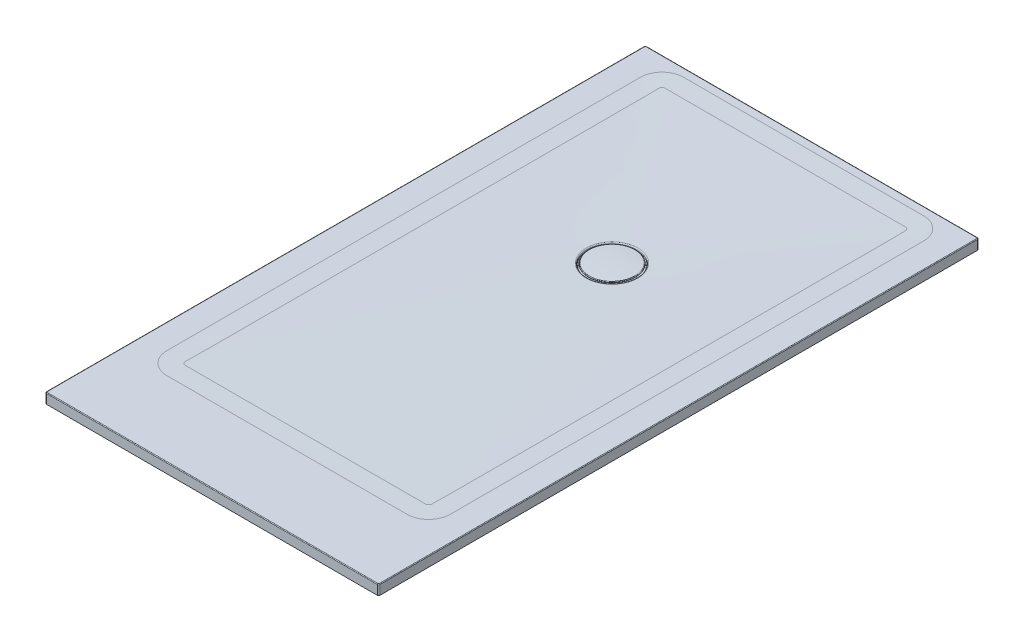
SolidWorks part; units mm, degrees
ref_plane "Płaszczyzna przednia" through (0, 0, 0) normal (0, 0, 1) x (1, 0, 0)
ref_plane "Płaszczyzna górna" through (0, 0, 0) normal (0, 1, 0) x (1, 0, 0)
ref_plane "Płaszczyzna prawa" through (0, 0, 0) normal (1, 0, 0) x (0, 0, -1)
sketch "Szkic2" plane through (0, 0, 0) normal (0, 1, 0) x (1, 0, 0)
  line L0 (0, 900) -> (0, 300) construction
  line L1 (-500, -900) -> (500, -900)
  line L2 (-500, -900) -> (-500, 900)
  line L3 (-500, 900) -> (500, 900)
  line L4 (500, -900) -> (500, 900)
  line L5 (-500, -900) -> (500, 900) construction
  line L6 (-500, 900) -> (500, -900) construction
  line L7 (-410, 860) -> (410, 860)
  line L8 (-410, 860) -> (-410, -660)
  line L9 (-410, -660) -> (410, -660)
  line L10 (410, 860) -> (410, -660)
  line L11 (-450, 900) -> (-450, -700) construction
  line L12 (-450, -700) -> (450, -700) construction
  line L13 (450, -700) -> (450, 900) construction
  circle A0 centre (0, 300) radius 75
  point P0 (0, 0)
  point P11 (0, 860)
  point P16 (0, -700)
  dimension "D9" = 150
  dimension "D1" = 1000
  dimension "D2" = 1800
  dimension "D3" = 40
  dimension "D4" = 90
  dimension "D5" = 40
  dimension "D6" = 50
  dimension "D7" = 1600
  dimension "D8" = 600
  dimension "D10" = 900
sketch "Szkic3" plane through (0, 0, 0) normal (0, 1, 0) x (1, 0, 0)
  line L0 (-500, -900) -> (-500, 900) construction
  line L1 (-500, -900) -> (500, -900) construction
  line L2 (500, -900) -> (500, 900) construction
  line L3 (-500, 900) -> (500, 900) construction
  line L4 (-410, 860) -> (-410, -660) construction
  line L5 (-410, 860) -> (410, 860) construction
  line L6 (410, 860) -> (410, -660) construction
  line L7 (-410, -660) -> (410, -660) construction
  line L8 (-500, -900) -> (-500, 900)
  line L9 (-500, -900) -> (500, -900)
  line L10 (500, -900) -> (500, 900)
  line L11 (-500, 900) -> (500, 900)
  line L12 (-410, 810) -> (-410, -610)
  line L13 (-360, 860) -> (360, 860)
  line L14 (410, 810) -> (410, -610)
  line L15 (-360, -660) -> (360, -660)
  arc A0 (410, 810) -> (360, 860) centre (360, 810) ccw
  arc A1 (-360, 860) -> (-410, 810) centre (-360, 810) ccw
  arc A2 (360, -660) -> (410, -610) centre (360, -610) ccw
  arc A3 (-360, -660) -> (-410, -610) centre (-360, -610) cw
  dimension "D1" = 50
surface "Powierzchnia-Płaszczyzna1" sketch "Szkic3"
sketch "Szkic4" plane through (0, 0, 0) normal (0, 1, 0) x (1, 0, 0)
  line L0 (-410, 860) -> (-410, -660) construction
  line L1 (-410, -660) -> (410, -660) construction
  line L2 (410, 860) -> (410, -660) construction
  line L3 (-410, 860) -> (410, 860) construction
  line L4 (-410, 860) -> (-410, -660)
  line L5 (-410, -660) -> (410, -660)
  line L6 (410, 860) -> (410, -660)
  line L7 (-410, 860) -> (410, 860)
ref_plane "korek" through (0, -15, 0) normal (0, 1, 0) x (-1, 0, 0)
sketch "Szkic5" plane through (0, -15, 0) normal (0, 1, 0) x (-1, 0, 0)
  circle A0 centre (0, -300) radius 75 construction
  circle A1 centre (0, -300) radius 75
surface "Powierzchnia-Wyciągnięcie po profilach2"
surface "Powierzchnia-Połącz1"
sketch "Szkic7" plane through (0, 0, 0) normal (0, 1, 0) x (1, 0, 0)
  line L27 (360, 820) -> (-360, 820)
  line L28 (-370, 810) -> (-370, -610)
  line L29 (-360, -620) -> (360, -620)
  line L30 (370, -610) -> (370, 810)
  line L31 (360, 820) -> (-360, 820)
  line L32 (-370, 810) -> (-370, -610)
  line L33 (-360, -620) -> (360, -620)
  line L34 (370, -610) -> (370, 810)
  line L35 (360, 875) -> (-360, 875)
  line L36 (-425, 810) -> (-425, -610)
  line L37 (-360, -675) -> (360, -675)
  line L38 (425, -610) -> (425, 810)
  line L39 (360, 875) -> (-360, 875)
  line L40 (-425, 810) -> (-425, -610)
  line L41 (-360, -675) -> (360, -675)
  line L42 (425, -610) -> (425, 810)
  arc A0 (370, -610) -> (360, -620) centre (360, -610) cw
  arc A1 (-370, -610) -> (-360, -620) centre (-360, -610) ccw
  arc A2 (370, 810) -> (360, 820) centre (360, 810) ccw
  arc A3 (-370, 810) -> (-360, 820) centre (-360, 810) cw
  spline S23 degree 3 poles (-582.3664, 505.0465) (46.9984, 660.4805) (379.1477, 765.2945) (369.7444, 812.2675) (369.6661, 812.5844) (369.4755, 813.2122) (369.3642, 813.5244) (368.9879, 814.432) (368.6813, 815.0063) (368.1376, 815.8211) (367.9417, 816.0859) (367.5238, 816.5954) (367.304, 816.8379) (366.6128, 817.5298) (366.1097, 817.9437) (365.2907, 818.4922) (365.0069, 818.6625) (364.4301, 818.9712) (364.1355, 819.1106) (363.5344, 819.3602) (363.2278, 819.4704) (362.6024, 819.661) (362.2821, 819.7417) (313.3263, 829.5374) (223.8319, 472.199) (105.1886, -146.9906) knots -9.007949 -9.007949 -9.007949 -9.007949 0.125 0.125 0.1875 0.1875 0.25 0.25 0.375 0.375 0.4375 0.4375 0.5 0.5 0.625 0.625 0.6875 0.6875 0.75 0.75 0.8125 0.8125 0.875 0.875 10.287391 10.287391 10.287391 10.287391 only from (370, 810) to (360, 820)
  spline S24 degree 3 poles (-85.6023, -141.6157) (-254.9589, 632.3728) (-325.6449, 827.028) (-362.2675, 819.745) (-362.5842, 819.6659) (-363.2121, 819.4758) (-363.5241, 819.3642) (-364.432, 818.9882) (-365.0061, 818.6814) (-366.0927, 817.9565) (-366.6073, 817.5346) (-367.5296, 816.6128) (-367.9435, 816.1099) (-368.492, 815.291) (-368.6623, 815.0071) (-368.971, 814.4303) (-369.1104, 814.1358) (-369.3602, 813.5347) (-369.4701, 813.228) (-369.6611, 812.6028) (-369.741, 812.2824) (-385.1866, 735.5658) (524.7544, 556.2282) (-1362.5299, 688.0877) knots -6.980574 -6.980574 -6.980574 -6.980574 0.125 0.125 0.1875 0.1875 0.25 0.25 0.375 0.375 0.5 0.5 0.625 0.625 0.6875 0.6875 0.75 0.75 0.8125 0.8125 0.875 0.875 15.659656 15.659656 15.659656 15.659656 only from (-360, 820) to (-370, 810)
  spline S25 degree 3 poles (582.3661, -305.0466) (-46.9984, -460.4805) (-379.1477, -565.2945) (-369.7444, -612.2675) (-369.6661, -612.5844) (-369.4755, -613.2122) (-369.3642, -613.5244) (-368.9879, -614.432) (-368.6813, -615.0063) (-368.1376, -615.8211) (-367.9417, -616.0859) (-367.5238, -616.5954) (-367.304, -616.8379) (-366.6128, -617.5298) (-366.1097, -617.9437) (-365.2907, -618.4922) (-365.0069, -618.6625) (-364.4301, -618.9712) (-364.1355, -619.1106) (-363.5344, -619.3602) (-363.2278, -619.4704) (-362.6024, -619.661) (-362.2821, -619.7417) (-313.3263, -629.5374) (-223.8319, -272.199) (-105.1886, 346.9907) knots -9.007949 -9.007949 -9.007949 -9.007949 0.125 0.125 0.1875 0.1875 0.25 0.25 0.375 0.375 0.4375 0.4375 0.5 0.5 0.625 0.625 0.6875 0.6875 0.75 0.75 0.8125 0.8125 0.875 0.875 10.287391 10.287391 10.287391 10.287391 only from (-370, -610) to (-360, -620)
  spline S26 degree 3 poles (85.6023, 341.6158) (254.9589, -432.3728) (325.6449, -627.028) (362.2675, -619.745) (362.5842, -619.6659) (363.2121, -619.4758) (363.5241, -619.3642) (364.432, -618.9882) (365.0061, -618.6814) (366.0927, -617.9565) (366.6073, -617.5346) (367.5296, -616.6128) (367.9435, -616.1099) (368.492, -615.291) (368.6623, -615.0071) (368.971, -614.4303) (369.1104, -614.1358) (369.3602, -613.5347) (369.4701, -613.228) (369.6611, -612.6028) (369.741, -612.2824) (385.1866, -535.5658) (-524.7544, -356.2282) (1362.5299, -488.0877) knots -6.980574 -6.980574 -6.980574 -6.980574 0.125 0.125 0.1875 0.1875 0.25 0.25 0.375 0.375 0.5 0.5 0.625 0.625 0.6875 0.6875 0.75 0.75 0.8125 0.8125 0.875 0.875 15.659656 15.659656 15.659656 15.659656 only from (360, -620) to (370, -610)
  spline S31 degree 3 poles (3399.9778, 876.3572) (-78.4128, 431.6929) (432.1993, 666.5609) (424.8689, 814.2695) (424.7892, 815.3289) (424.4773, 818.4946) (424.1673, 820.5877) (423.3417, 824.7388) (422.8286, 826.7973) (421.9014, 829.8582) (421.5658, 830.8758) (420.8441, 832.8944) (420.4597, 833.8907) (418.4226, 838.8081) (416.4285, 842.5401) (413.4836, 846.9544) (412.8719, 847.8246) (411.6021, 849.5394) (410.9423, 850.3861) (408.9053, 852.8702) (407.4762, 854.4465) (402.9827, 858.9434) (399.7135, 861.634) (395.2774, 864.6045) (394.3699, 865.1802) (392.5354, 866.2814) (391.6079, 866.8073) (388.7958, 868.3123) (386.8813, 869.2189) (382.9739, 870.8414) (380.981, 871.5574) (377.9322, 872.4865) (376.906, 872.7721) (374.8333, 873.2938) (373.7849, 873.5305) (177.0178, 912.8534) (-119.6822, 42.8233) (-543.2281, -1969.1992) knots -4.275923 -4.275923 -4.275923 -4.275923 0.03125 0.03125 0.0625 0.0625 0.125 0.125 0.1875 0.1875 0.21875 0.21875 0.25 0.25 0.375 0.375 0.40625 0.40625 0.4375 0.4375 0.5 0.5 0.625 0.625 0.65625 0.65625 0.6875 0.6875 0.75 0.75 0.8125 0.8125 0.84375 0.84375 0.875 0.875 6.701949 6.701949 6.701949 6.701949 only from (425, 810) to (360, 875)
  spline S32 degree 3 poles (616.3942, -1946.861) (62.7717, 308.2506) (-208.6493, 906.3376) (-374.7389, 873.3423) (-376.7972, 872.8283) (-379.8582, 871.9015) (-380.8758, 871.5658) (-382.8943, 870.8441) (-383.8906, 870.4597) (-388.8081, 868.4229) (-392.54, 866.4285) (-396.9543, 863.4837) (-397.8245, 862.8719) (-399.5394, 861.6021) (-400.3861, 860.9423) (-402.8702, 858.9053) (-404.4465, 857.4764) (-408.9432, 852.9828) (-411.6339, 849.7137) (-414.6044, 845.2776) (-415.1801, 844.3701) (-416.2813, 842.5356) (-416.8072, 841.6082) (-418.3122, 838.7961) (-419.2187, 836.8815) (-420.8414, 832.9742) (-421.5571, 830.9813) (-422.4865, 827.9326) (-422.7721, 826.9064) (-423.2937, 824.8336) (-423.5301, 823.7852) (-424.16, 820.6363) (-424.4736, 818.5252) (-424.7883, 815.3413) (-424.8684, 814.2772) (-431.8456, 673.8963) (29.9418, 482.4963) (-3402.2641, 723.8212) knots -4.813616 -4.813616 -4.813616 -4.813616 0.125 0.125 0.1875 0.1875 0.21875 0.21875 0.25 0.25 0.375 0.375 0.40625 0.40625 0.4375 0.4375 0.5 0.5 0.625 0.625 0.65625 0.65625 0.6875 0.6875 0.75 0.75 0.8125 0.8125 0.84375 0.84375 0.875 0.875 0.9375 0.9375 0.96875 0.96875 5.048673 5.048673 5.048673 5.048673 only from (-360, 875) to (-425, 810)
  spline S33 degree 3 poles (-3399.9774, -676.3572) (78.4128, -231.6929) (-432.1993, -466.5609) (-424.8689, -614.2695) (-424.7892, -615.3289) (-424.4773, -618.4946) (-424.1673, -620.5877) (-423.3417, -624.7388) (-422.8286, -626.7973) (-421.9014, -629.8582) (-421.5658, -630.8758) (-420.8441, -632.8944) (-420.4597, -633.8907) (-418.4226, -638.8081) (-416.4285, -642.5401) (-413.4836, -646.9544) (-412.8719, -647.8246) (-411.6021, -649.5394) (-410.9423, -650.3861) (-408.9053, -652.8702) (-407.4762, -654.4465) (-402.9827, -658.9434) (-399.7135, -661.634) (-395.2774, -664.6045) (-394.3699, -665.1802) (-392.5354, -666.2814) (-391.6079, -666.8073) (-388.7958, -668.3123) (-386.8813, -669.2189) (-382.9739, -670.8414) (-380.981, -671.5574) (-377.9322, -672.4865) (-376.906, -672.7721) (-374.8333, -673.2938) (-373.7849, -673.5305) (-177.0178, -712.8534) (119.6822, 157.1767) (543.2281, 2169.1992) knots -4.275923 -4.275923 -4.275923 -4.275923 0.03125 0.03125 0.0625 0.0625 0.125 0.125 0.1875 0.1875 0.21875 0.21875 0.25 0.25 0.375 0.375 0.40625 0.40625 0.4375 0.4375 0.5 0.5 0.625 0.625 0.65625 0.65625 0.6875 0.6875 0.75 0.75 0.8125 0.8125 0.84375 0.84375 0.875 0.875 6.701949 6.701949 6.701949 6.701949 only from (-425, -610) to (-360, -675)
  spline S34 degree 3 poles (-616.3942, 2146.861) (-62.7717, -108.2506) (208.6493, -706.3376) (374.7389, -673.3423) (376.7972, -672.8283) (379.8582, -671.9015) (380.8758, -671.5658) (382.8943, -670.8441) (383.8906, -670.4597) (388.8081, -668.4229) (392.54, -666.4285) (396.9543, -663.4837) (397.8245, -662.8719) (399.5394, -661.6021) (400.3861, -660.9423) (402.8702, -658.9053) (404.4465, -657.4764) (408.9432, -652.9828) (411.6339, -649.7137) (414.6044, -645.2776) (415.1801, -644.3701) (416.2813, -642.5356) (416.8072, -641.6082) (418.3122, -638.7961) (419.2187, -636.8815) (420.8414, -632.9742) (421.5571, -630.9813) (422.4865, -627.9326) (422.7721, -626.9064) (423.2937, -624.8336) (423.5301, -623.7852) (424.16, -620.6363) (424.4736, -618.5252) (424.7883, -615.3413) (424.8684, -614.2772) (431.8456, -473.8963) (-29.9418, -282.4963) (3402.2641, -523.8212) knots -4.813616 -4.813616 -4.813616 -4.813616 0.125 0.125 0.1875 0.1875 0.21875 0.21875 0.25 0.25 0.375 0.375 0.40625 0.40625 0.4375 0.4375 0.5 0.5 0.625 0.625 0.65625 0.65625 0.6875 0.6875 0.75 0.75 0.8125 0.8125 0.84375 0.84375 0.875 0.875 0.9375 0.9375 0.96875 0.96875 5.048673 5.048673 5.048673 5.048673 only from (360, -675) to (425, -610)
  spline S35 degree 3 poles (425, 810) (425, 811.073) (424.9745, 812.1416) (424.8689, 814.2695) (424.7892, 815.3289) (424.4773, 818.4946) (424.1673, 820.5877) (423.3417, 824.7388) (422.8286, 826.7973) (421.9014, 829.8582) (421.5658, 830.8758) (420.8441, 832.8944) (420.4597, 833.8907) (418.4226, 838.8081) (416.4285, 842.5401) (413.4836, 846.9544) (412.8719, 847.8246) (411.6021, 849.5394) (410.9423, 850.3861) (408.9053, 852.8702) (407.4762, 854.4465) (402.9827, 858.9434) (399.7135, 861.634) (395.2774, 864.6045) (394.3699, 865.1802) (392.5354, 866.2814) (391.6079, 866.8073) (388.7958, 868.3123) (386.8813, 869.2189) (382.9739, 870.8414) (380.981, 871.5574) (377.9322, 872.4865) (376.906, 872.7721) (374.8333, 873.2938) (373.7849, 873.5305) (368.5368, 874.5793) (364.2917, 875) (360, 875) knots 0 0 0 0 0.03125 0.03125 0.0625 0.0625 0.125 0.125 0.1875 0.1875 0.21875 0.21875 0.25 0.25 0.375 0.375 0.40625 0.40625 0.4375 0.4375 0.5 0.5 0.625 0.625 0.65625 0.65625 0.6875 0.6875 0.75 0.75 0.8125 0.8125 0.84375 0.84375 0.875 0.875 1 1 1 1
  spline S36 degree 3 poles (-360, 875) (-364.2918, 875) (-368.5119, 874.5793) (-374.7389, 873.3423) (-376.7972, 872.8283) (-379.8582, 871.9015) (-380.8758, 871.5658) (-382.8943, 870.8441) (-383.8906, 870.4597) (-388.8081, 868.4229) (-392.54, 866.4285) (-396.9543, 863.4837) (-397.8245, 862.8719) (-399.5394, 861.6021) (-400.3861, 860.9423) (-402.8702, 858.9053) (-404.4465, 857.4764) (-408.9432, 852.9828) (-411.6339, 849.7137) (-414.6044, 845.2776) (-415.1801, 844.3701) (-416.2813, 842.5356) (-416.8072, 841.6082) (-418.3122, 838.7961) (-419.2187, 836.8815) (-420.8414, 832.9742) (-421.5571, 830.9813) (-422.4865, 827.9326) (-422.7721, 826.9064) (-423.2937, 824.8336) (-423.5301, 823.7852) (-424.16, 820.6363) (-424.4736, 818.5252) (-424.7883, 815.3413) (-424.8684, 814.2772) (-424.9745, 812.1431) (-425, 811.073) (-425, 810) knots 0 0 0 0 0.125 0.125 0.1875 0.1875 0.21875 0.21875 0.25 0.25 0.375 0.375 0.40625 0.40625 0.4375 0.4375 0.5 0.5 0.625 0.625 0.65625 0.65625 0.6875 0.6875 0.75 0.75 0.8125 0.8125 0.84375 0.84375 0.875 0.875 0.9375 0.9375 0.96875 0.96875 1 1 1 1
  spline S37 degree 3 poles (-425, -610) (-425, -611.073) (-424.9745, -612.1416) (-424.8689, -614.2695) (-424.7892, -615.3289) (-424.4773, -618.4946) (-424.1673, -620.5877) (-423.3417, -624.7388) (-422.8286, -626.7973) (-421.9014, -629.8582) (-421.5658, -630.8758) (-420.8441, -632.8944) (-420.4597, -633.8907) (-418.4226, -638.8081) (-416.4285, -642.5401) (-413.4836, -646.9544) (-412.8719, -647.8246) (-411.6021, -649.5394) (-410.9423, -650.3861) (-408.9053, -652.8702) (-407.4762, -654.4465) (-402.9827, -658.9434) (-399.7135, -661.634) (-395.2774, -664.6045) (-394.3699, -665.1802) (-392.5354, -666.2814) (-391.6079, -666.8073) (-388.7958, -668.3123) (-386.8813, -669.2189) (-382.9739, -670.8414) (-380.981, -671.5574) (-377.9322, -672.4865) (-376.906, -672.7721) (-374.8333, -673.2938) (-373.7849, -673.5305) (-368.5368, -674.5793) (-364.2917, -675) (-360, -675) knots 0 0 0 0 0.03125 0.03125 0.0625 0.0625 0.125 0.125 0.1875 0.1875 0.21875 0.21875 0.25 0.25 0.375 0.375 0.40625 0.40625 0.4375 0.4375 0.5 0.5 0.625 0.625 0.65625 0.65625 0.6875 0.6875 0.75 0.75 0.8125 0.8125 0.84375 0.84375 0.875 0.875 1 1 1 1
  spline S38 degree 3 poles (360, -675) (364.2918, -675) (368.5119, -674.5793) (374.7389, -673.3423) (376.7972, -672.8283) (379.8582, -671.9015) (380.8758, -671.5658) (382.8943, -670.8441) (383.8906, -670.4597) (388.8081, -668.4229) (392.54, -666.4285) (396.9543, -663.4837) (397.8245, -662.8719) (399.5394, -661.6021) (400.3861, -660.9423) (402.8702, -658.9053) (404.4465, -657.4764) (408.9432, -652.9828) (411.6339, -649.7137) (414.6044, -645.2776) (415.1801, -644.3701) (416.2813, -642.5356) (416.8072, -641.6082) (418.3122, -638.7961) (419.2187, -636.8815) (420.8414, -632.9742) (421.5571, -630.9813) (422.4865, -627.9326) (422.7721, -626.9064) (423.2937, -624.8336) (423.5301, -623.7852) (424.16, -620.6363) (424.4736, -618.5252) (424.7883, -615.3413) (424.8684, -614.2772) (424.9745, -612.1431) (425, -611.073) (425, -610) knots 0 0 0 0 0.125 0.125 0.1875 0.1875 0.21875 0.21875 0.25 0.25 0.375 0.375 0.40625 0.40625 0.4375 0.4375 0.5 0.5 0.625 0.625 0.65625 0.65625 0.6875 0.6875 0.75 0.75 0.8125 0.8125 0.84375 0.84375 0.875 0.875 0.9375 0.9375 0.96875 0.96875 1 1 1 1
  dimension "D3" = 10
  dimension "D1" = 40
  dimension "D2" = 15
other "Usuń ścianę1"
other "Granica-Powierzchnia1"
surface "Powierzchnia-Połącz2"
sketch "Szkic9" plane through (0, 0, 0) normal (0, 1, 0) x (1, 0, 0)
  line L0 (-500, -900) -> (500, -900) construction
  line L1 (-500, -900) -> (-500, 900) construction
  line L2 (500, -900) -> (500, 900) construction
  line L3 (-500, 900) -> (500, 900) construction
  line L4 (-500, -900) -> (500, -900)
  line L5 (-500, -900) -> (-500, 900)
  line L6 (500, -900) -> (500, 900)
  line L7 (-500, 900) -> (500, 900)
surface "Powierzchnia-Wyciągnięcie1" sketch "Szkic9" parameters "D1"=30
sketch "Szkic8" plane through (0, 0, 0) normal (1, 0, 0) x (0, 0, -1)
  line L0 (300, 0) -> (300, -30) construction
  line L1 (224.9999, -15) -> (225.2968, -23.5)
  line L4 (225.2968, -23.5) -> (248, -24.0945)
  line L5 (225.2968, -23.5) -> (300, -23.5) construction
  line L6 (248, -24.0945) -> (248, -30) construction
  line L7 (300, -30) -> (225.2968, -30) construction
  line L8 (225.2968, -30) -> (225.2968, -23.5) construction
  line L9 (255, -28) -> (255, -30)
  line L10 (248, -24.0945) -> (255, -28)
  dimension "D1" = 30
  dimension "D2" = 8.5
  dimension "D3" = 2
  dimension "D4" = 1.5
  dimension "D5" = 52
  dimension "D6" = 45
  dimension "D7" = 2
surface "Powierzchnia-Obrót1" sketch "Szkic8" parameters "D1"=360
surface "Powierzchnia-Płaszczyzna2"
surface "Powierzchnia-Połącz3"
fillet "Zaokrąglenie4" radius 4 4 edges at (-500, -15, -900) (500, -15, -900) (-500, -15, 900) (500, -15, 900)
fillet "Zaokrąglenie5" radius 3 3 edges at (0, -24.0945, -352) (0, -23.5, -374.7032)
fillet "Zaokrąglenie6" radius 2 9 edges at (498.8284, 0, 898.8284) (0, 0, 900) (-498.8284, 0, 898.8284) (-500, 0, 0) (-498.8284, 0, -898.8284) (0, 0, -900) (498.8284, 0, -898.8284) (500, 0, 0) (0, -28, -345)
sketch "Szkic11" plane through (0, 0, 0) normal (1, 0, 0) x (0, 0, -1)
  line L0 (300, 0) -> (300, -30) construction
  line L1 (-896, -30) -> (896, -30) construction
  line L2 (300, -17) -> (300, -11.5)
  line L14 (370, -11.5) -> (370, -14.5) construction
  line L16 (370, -17) -> (300, -17)
  line L18 (370, -17) -> (370, -16.3377)
  line L19 (300, -11.5) -> (370, -11.5) construction
  arc A0 (370, -16.3377) -> (368.1666, -14.3446) centre (368, -16.3377) ccw
  arc A6 (368.1666, -14.3446) -> (300, -11.5) centre (300, -829.6667) ccw
  dimension "D2" = 2
  dimension "D8" = 2.5
  dimension "D9" = 17
  dimension "D10" = 5.5
  dimension "D11" = 70
revolve "Obrót1" add sketch "Szkic11" angle 360 about L0
